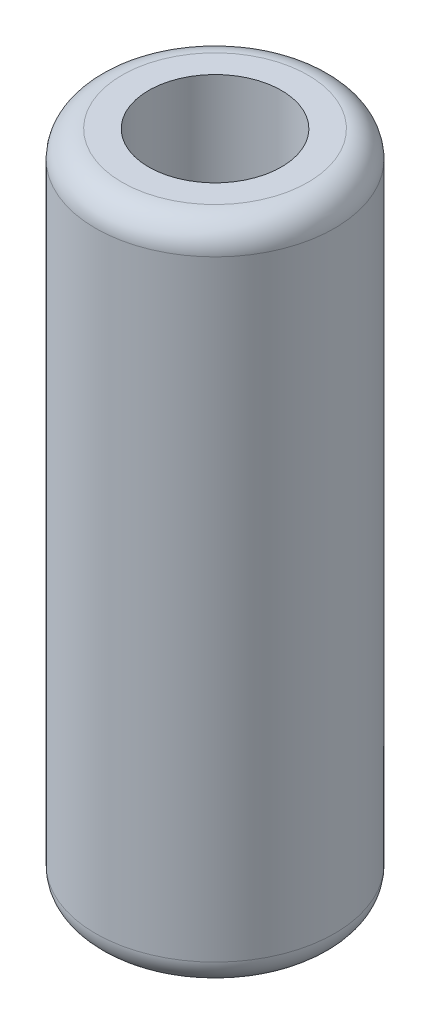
SolidWorks part; units mm, degrees
ref_plane "Front Plane" through (0, 0, 0) normal (0, 0, 1) x (1, 0, 0)
ref_plane "Top Plane" through (0, 0, 0) normal (0, 1, 0) x (1, 0, 0)
ref_plane "Right Plane" through (0, 0, 0) normal (1, 0, 0) x (0, 0, -1)
sketch "Sketch1" plane through (0, 0, 0) normal (0, 1, 0) x (1, 0, 0)
  circle A0 centre (0, 0) radius 2.5
  circle A1 centre (0, 0) radius 4.5
  dimension "D1" = 2
  dimension "D2" = 5
extrude "Boss-Extrude1" add sketch "Sketch1" along normal blind 25
fillet "Fillet1" radius 1 3 edges at (0, 0, 2.5) (0, 0, 4.5) (0, 25, 4.5)
